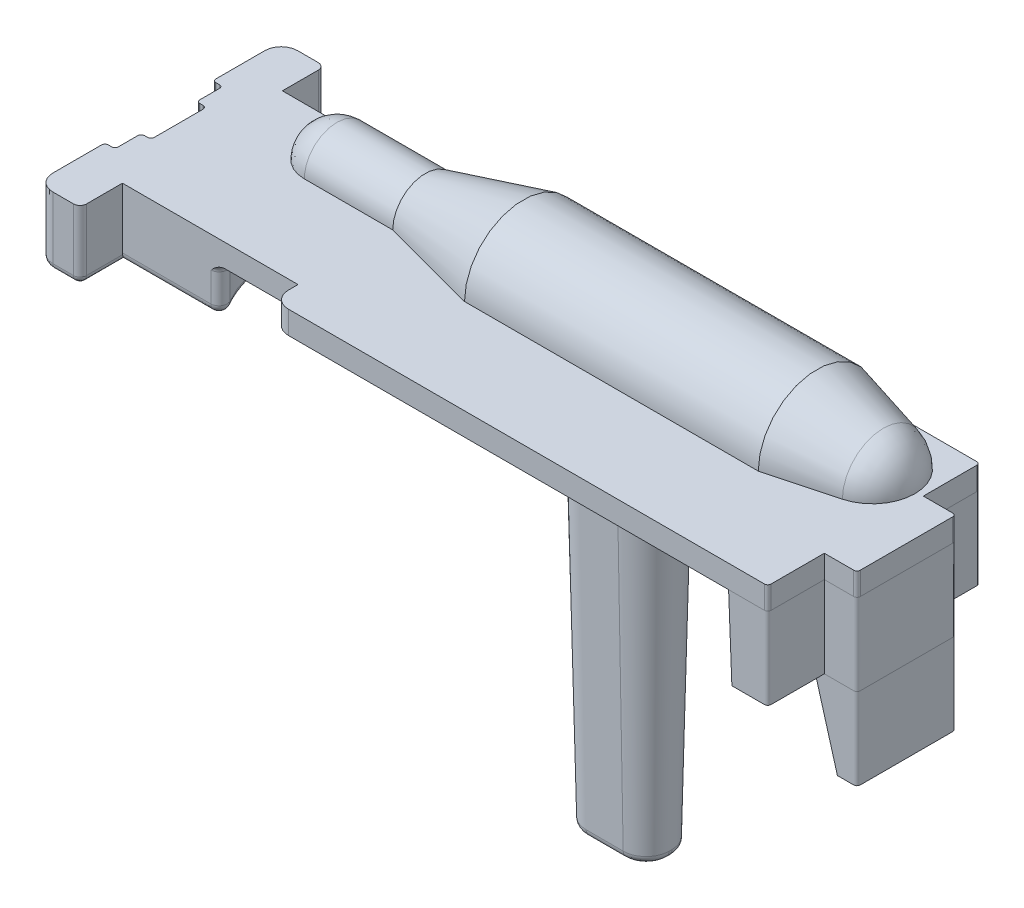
SolidWorks part; units mm, degrees
ref_plane "Front Plane" through (0, 0, 0) normal (0, 0, 1) x (1, 0, 0)
ref_plane "Top Plane" through (0, 0, 0) normal (0, 1, 0) x (1, 0, 0)
ref_plane "Right Plane" through (0, 0, 0) normal (1, 0, 0) x (0, 0, -1)
imported_body "Imported1"
ref_plane "Plane1" through (0, 0, 3.683) normal (0, 0, -1) x (-1, 0, 0)
sketch "Sketch1" plane through (0, 0, 0) normal (0, 1, 0) x (1, 0, 0)
  line L0 (0.1224, -1.6331) -> (0.9369, -2.4476)
  line L1 (-5.4488, -1.6331) -> (0.1224, -1.6331)
  line L2 (-5.4488, -1.6331) -> (-5.4488, -9.1825)
  line L3 (-5.4488, -9.1825) -> (0.9369, -9.1825)
  line L4 (0.9369, -2.4476) -> (0.9369, -9.1825)
  line L6 (12.5339, -6.41) -> (44.4346, -6.41)
  line L7 (12.5339, -6.41) -> (12.5339, -11.1991)
  line L8 (12.5339, -11.1991) -> (44.4346, -11.1991)
  line L9 (44.4346, -6.41) -> (44.4346, -11.1991)
extrude "Boss-Extrude1" add sketch "Sketch1" against normal up to surface (1.778 mm away)
